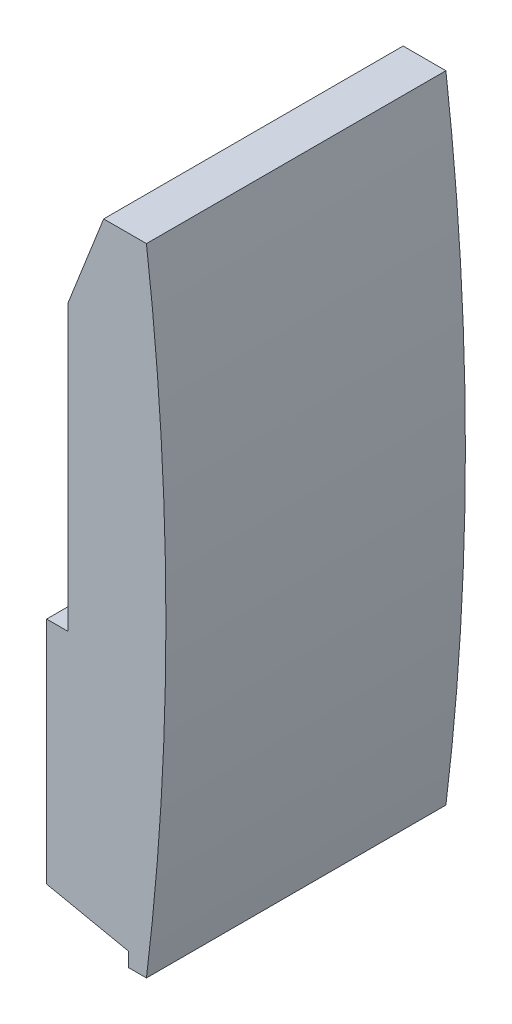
SolidWorks part; units mm, degrees
ref_plane "Plan de face" through (0, 0, 0) normal (0, 0, 1) x (1, 0, 0)
ref_plane "Plan de dessus" through (0, 0, 0) normal (0, 1, 0) x (1, 0, 0)
ref_plane "Plan de droite" through (0, 0, 0) normal (1, 0, 0) x (0, 0, -1)
sketch "Esquisse1" plane through (0, 0, 0) normal (0, 0, 1) x (1, 0, 0)
  line L0 (349, -40.2) -> (360.5, -42.6)
  line L1 (360.5, -42.6) -> (360.5, -44.6)
  line L2 (360.5, -44.6) -> (363, -44.6)
  line L3 (349, -40.2) -> (349, -8)
  line L4 (349, -8) -> (352, -8)
  line L5 (352, -8) -> (352, 31.9)
  line L6 (352, 31.9) -> (357, 44.6)
  line L7 (357, 44.6) -> (363, 44.6)
  line L8 (0, 0) -> (352, 0) construction
  arc A0 (363, 44.6) -> (363, -44.6) centre (0, 0) cw
  dimension "D1" = 2.5
  dimension "D2" = 2
  dimension "D3" = 14
  dimension "D4" = 4.4
  dimension "D5" = 32.2
  dimension "D6" = 3
  dimension "D7" = 8
  dimension "D9" = 6
  dimension "D10" = 12.7
  dimension "D11" = 352
extrude "Boss.-Extru.1" add sketch "Esquisse1" along normal mid plane 42
